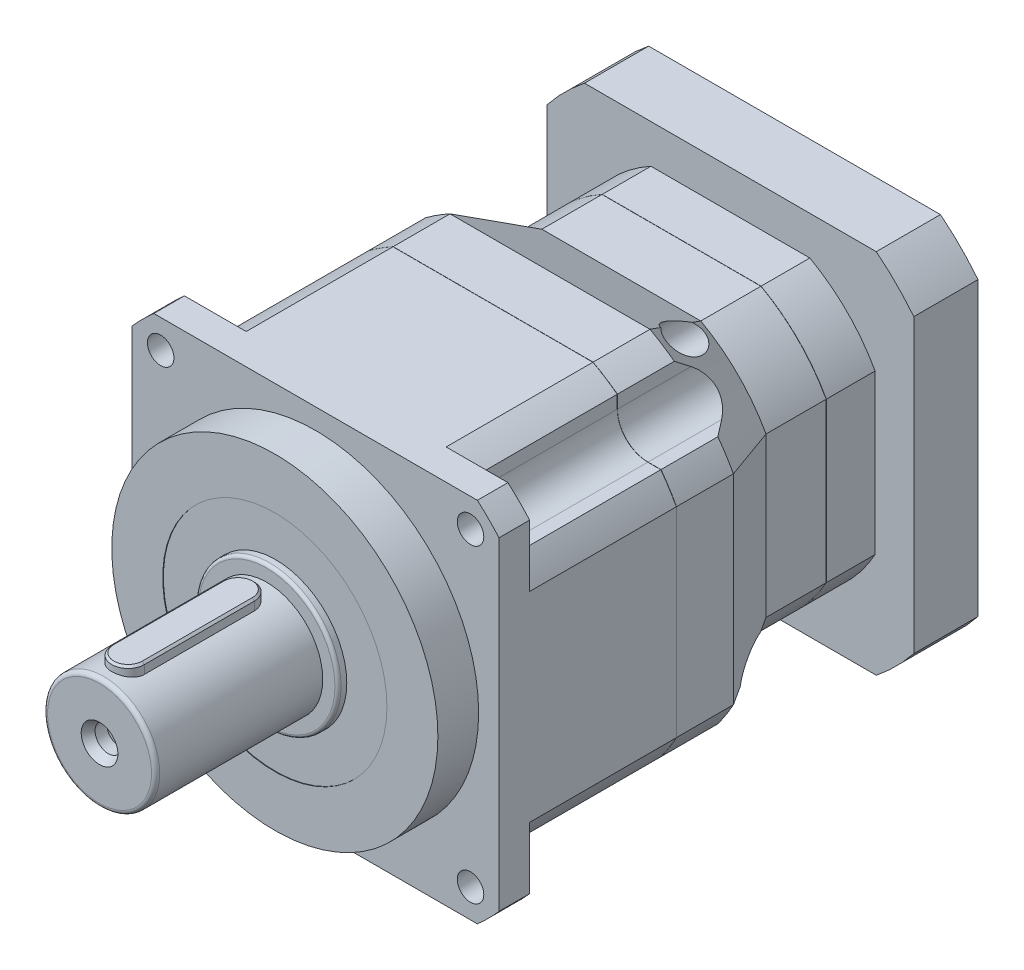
SolidWorks part; units mm, degrees
ref_plane "前视基准面" through (0, 0, 0) normal (0, 0, 1) x (1, 0, 0)
ref_plane "上视基准面" through (0, 0, 0) normal (0, 1, 0) x (1, 0, 0)
ref_plane "右视基准面" through (0, 0, 0) normal (1, 0, 0) x (0, 0, -1)
sketch "草图1" plane through (0, 0, 0) normal (0, 0, 1) x (1, 0, 0)
  line L1 (-79.3725, 90) -> (79.3725, 90)
  line L2 (-90, 79.3725) -> (-90, -79.3725)
  line L3 (-79.3725, -90) -> (79.3725, -90)
  line L4 (90, 79.3725) -> (90, -79.3725)
  arc A0 (-79.3725, 90) -> (-90, 79.3725) centre (0, 0) ccw
  arc A1 (90, 79.3725) -> (79.3725, 90) centre (0, 0) ccw
  arc A2 (79.3725, -90) -> (90, -79.3725) centre (0, 0) ccw
  arc A3 (-90, -79.3725) -> (-79.3725, -90) centre (0, 0) ccw
  dimension "D1" = 90
  dimension "D3" = 90
extrude "凸台-拉伸1" add sketch "草图1" along normal blind 15
sketch "草图2" plane through (0, 0, 15) normal (0, 0, 1) x (1, 0, 0)
  circle A0 centre (0, 0) radius 80
extrude "凸台-拉伸2" add sketch "草图2" along normal blind 20
sketch "草图3" plane through (0, 0, 0) normal (0, 0, -1) x (-1, 0, 0)
  line L0 (-79.3725, 90) -> (79.3725, 90) construction
  line L1 (90, 79.3725) -> (90, -79.3725) construction
  line L2 (79.3725, -90) -> (-79.3725, -90) construction
  line L3 (-90, -79.3725) -> (-90, 79.3725) construction
  line L4 (-49.0535, 90) -> (49.0535, 90)
  line L5 (90, 49.0535) -> (90, -49.0535)
  line L6 (49.0535, -90) -> (-49.0535, -90)
  line L7 (-90, -49.0535) -> (-90, 49.0535)
  arc A0 (-49.0535, 90) -> (-90, 49.0535) centre (0, 0) ccw
  arc A1 (-90, -49.0535) -> (-49.0535, -90) centre (0, 0) ccw
  arc A2 (49.0535, -90) -> (90, -49.0535) centre (0, 0) ccw
  arc A3 (90, 49.0535) -> (49.0535, 90) centre (0, 0) ccw
extrude "凸台-拉伸3" add sketch "草图3" along normal blind 72
sketch "草图4" plane through (0, 0, -72) normal (0, 0, -1) x (-1, 0, 0)
  line L1 (-104.8113, 97.2781) -> (-61, 97.2781)
  line L2 (-104.8113, 97.2781) -> (-104.8113, 61)
  line L3 (-104.8113, 61) -> (-61, 61)
  line L4 (-61, 97.2781) -> (-61, 61)
  dimension "D1" = 61
  dimension "D2" = 61
extrude "切除-拉伸1" cut sketch "草图4" against normal up to surface (72 mm away)
pattern_circular "阵列(圆周)1" count 4 over 360 about axis through (0, 0, 0) along (0, 0, 1) of "切除-拉伸1"
fillet "圆角1" radius 15 4 edges at (61, -61, -36) (-61, -61, -36) (-61, 61, -36) (61, 61, -36)
ref_plane "基准面1" through (0, 0, -72.1) normal (0, 0, -1) x (-1, 0, 0)
sketch "草图5" plane through (0, 0, -72.1) normal (0, 0, -1) x (-1, 0, 0)
  line L1 (-49.0535, 90) -> (49.0535, 90)
  line L2 (-90, 49.0535) -> (-90, -49.0535)
  line L3 (-49.0535, -90) -> (49.0535, -90)
  line L4 (90, 49.0535) -> (90, -49.0535)
  arc A0 (-49.0535, 90) -> (-90, 49.0535) centre (0, 0) ccw
  arc A1 (-90, -49.0535) -> (-49.0535, -90) centre (0, 0) ccw
  arc A2 (49.0535, -90) -> (90, -49.0535) centre (0, 0) ccw
  arc A3 (90, 49.0535) -> (49.0535, 90) centre (0, 0) ccw
  dimension "D1" = 90
  dimension "D3" = 90
extrude "凸台-拉伸4" add sketch "草图5" along normal blind 27.9 separate body
ref_plane "基准面5" through (0, 0, -135) normal (0, 0, -1) x (-1, 0, 0)
sketch "草图25" plane through (0, 0, -135) normal (0, 0, -1) x (-1, 0, 0)
  line L1 (-38.9872, 71) -> (38.9872, 71)
  line L2 (-71, 38.9872) -> (-71, -38.9872)
  line L3 (-38.9872, -71) -> (38.9872, -71)
  line L4 (71, 38.9872) -> (71, -38.9872)
  arc A0 (-38.9872, 71) -> (-71, 38.9872) centre (0, 0) ccw
  arc A1 (-71, -38.9872) -> (-38.9872, -71) centre (0, 0) ccw
  arc A2 (38.9872, -71) -> (71, -38.9872) centre (0, 0) ccw
  arc A3 (71, 38.9872) -> (38.9872, 71) centre (0, 0) ccw
  dimension "D1" = 71
  dimension "D3" = 71
extrude "凸台-拉伸12" add sketch "草图25" along normal blind 29.5 separate body
loft "放样1" add
sketch "草图7" plane through (0, 0, -72.1) normal (0, 0, 1) x (1, 0, 0)
  line L0 (61, 76) -> (61, 82.3726) construction
  line L1 (82.3726, 61) -> (76, 61) construction
  line L2 (61, 76) -> (61, 82.3726)
  line L3 (82.3726, 61) -> (76, 61)
  arc A0 (61, 76) -> (76, 61) centre (76, 76) ccw construction
  arc A1 (61, 76) -> (76, 61) centre (76, 76) ccw
  arc A2 (82.3726, 61) -> (61, 82.3726) centre (0, 0) ccw
extrude "切除-拉伸2" cut sketch "草图7" against normal blind 60
pattern_circular "阵列(圆周)2" count 4 over 360 about axis through (0, 0, 0) along (0, 0, 1) of "切除-拉伸2"
ref_plane "基准面2" through (0, 0, -164.6) normal (0, 0, -1) x (-1, 0, 0)
sketch "草图8" plane through (0, 0, -164.6) normal (0, 0, -1) x (-1, 0, 0)
  line L4 (38.9872, 71) -> (-38.9872, 71) construction
  line L5 (-71, 38.9872) -> (-71, -38.9872) construction
  line L6 (-38.9872, -71) -> (38.9872, -71) construction
  line L7 (71, -38.9872) -> (71, 38.9872) construction
  line L8 (38.9872, 71) -> (-38.9872, 71)
  line L9 (-71, 38.9872) -> (-71, -38.9872)
  line L10 (-38.9872, -71) -> (38.9872, -71)
  line L11 (71, -38.9872) -> (71, 38.9872)
  arc A4 (71, 38.9872) -> (38.9872, 71) centre (0, 0) ccw construction
  arc A5 (-38.9872, 71) -> (-71, 38.9872) centre (0, 0) ccw construction
  arc A6 (-71, -38.9872) -> (-38.9872, -71) centre (0, 0) ccw construction
  arc A7 (38.9872, -71) -> (71, -38.9872) centre (0, 0) ccw construction
  arc A8 (71, 38.9872) -> (38.9872, 71) centre (0, 0) ccw
  arc A9 (-38.9872, 71) -> (-71, 38.9872) centre (0, 0) ccw
  arc A10 (-71, -38.9872) -> (-38.9872, -71) centre (0, 0) ccw
  arc A11 (38.9872, -71) -> (71, -38.9872) centre (0, 0) ccw
extrude "凸台-拉伸5" add sketch "草图8" along normal blind 23.9 separate body
sketch "草图9" plane through (0, 0, -188.5) normal (0, 0, -1) x (-1, 0, 0)
  line L1 (-71.5891, 90) -> (71.5891, 90)
  line L2 (-90, 71.5891) -> (-90, -71.5891)
  line L3 (-71.5891, -90) -> (71.5891, -90)
  line L4 (90, 71.5891) -> (90, -71.5891)
  arc A0 (-71.5891, 90) -> (-90, 71.5891) centre (0, 0) ccw
  arc A1 (-90, -71.5891) -> (-71.5891, -90) centre (0, 0) ccw
  arc A2 (71.5891, -90) -> (90, -71.5891) centre (0, 0) ccw
  arc A3 (90, 71.5891) -> (71.5891, 90) centre (0, 0) ccw
  dimension "D5" = 180
  dimension "D2" = 115
  dimension "D1" = 90
  dimension "D3" = 90
  dimension "D4" = 180
extrude "凸台-拉伸6" add sketch "草图9" along normal blind 31.5
sketch "草图11" plane through (0, 0, -220) normal (0, 0, -1) x (-1, 0, 0)
  circle A0 centre (0, 0) radius 57.15
  dimension "D1" = 114.3
extrude "切除-拉伸3" cut sketch "草图11" against normal blind 8
sketch "草图12" plane through (0, 0, -212) normal (0, 0, -1) x (-1, 0, 0)
  circle A0 centre (0, 0) radius 56.5
extrude "切除-拉伸4" cut sketch "草图12" against normal blind 10.5
sketch "草图26" plane through (0, 0, -201.5) normal (0, 0, -1) x (-1, 0, 0)
  circle A0 centre (0, 0) radius 41.5
extrude "切除-拉伸10" cut sketch "草图26" against normal blind 33
ref_plane "基准面6" through (0, 0, -189) normal (0, 0, -1) x (-1, 0, 0)
sketch "草图27" plane through (0, 0, -189) normal (0, 0, -1) x (-1, 0, 0)
  circle A0 centre (0, 0) radius 37.5
extrude "凸台-拉伸13" add sketch "草图27" against normal up to surface (20.5 mm away)
sketch "草图28" plane through (0, 0, -220) normal (0, 0, -1) x (-1, 0, 0)
  line L0 (0, 0) -> (0, -55) construction
  line L1 (0, 0) -> (-27.5, -47.6314) construction
  circle A0 centre (0, 0) radius 55 construction
  circle A1 centre (-27.5, -47.6314) radius 9
  dimension "D1" = 30
extrude "切除-拉伸11" cut sketch "草图28" against normal blind 39.5
pattern_circular "阵列(圆周)7" count 6 over 360 about axis through (0, 0, 0) along (0, 0, 1) of "切除-拉伸11"
chamfer "倒角4" distance 1 angle 45 1 edges at (-37.5, 0, -189)
sketch "草图29" plane through (0, 0, -220) normal (0, 0, -1) x (-1, 0, 0)
  circle A0 centre (0, 0) radius 17.5
extrude "切除-拉伸12" cut sketch "草图29" against normal blind 85
sketch "草图30" plane through (0, 0, -189) normal (0, 0, -1) x (-1, 0, 0)
  line L1 (-39.1268, 0.5) -> (39.3984, 0.5)
  line L2 (-39.1268, 0.5) -> (-39.1268, -0.5)
  line L3 (-39.1268, -0.5) -> (39.3984, -0.5)
  line L4 (39.3984, 0.5) -> (39.3984, -0.5)
  dimension "D1" = 0.5
  dimension "D2" = 1
extrude "切除-拉伸13" cut sketch "草图30" against normal up to surface (20.5 mm away)
sketch "草图31" plane through (0, 0, -220) normal (0, 0, -1) x (-1, 0, 0)
  line L0 (0, 0) -> (-70.7107, -70.7107)
  circle A0 centre (0, 0) radius 100
hole_wizard "M12 螺纹孔2" positions "3D草图2" profile "草图32" tap size "M12" standard "GB"
sketch3d "3D草图2"
  point P0 (70.7107, -70.7107, -220)
sketch "草图32" plane through (70.7107, -70.7107, -220) normal (1, 0, 0) x (0, 1, 0)
  line L0 (0, 0) -> (0, 30.0644)
  line L1 (0, 30.0644) -> (5.1, 27)
  line L2 (5.1, 27) -> (5.1, 0)
  line L5 (5.1, 0) -> (0, 0)
  line L10 (0, 30.0644) -> (-5.1, 27) construction
  line L11 (0, -6.35) -> (0, 107.95) construction
  dimension "螺纹孔钻头直径" = 10.2
  dimension "螺纹孔钻头深度" = 27
  dimension "导头角度" = 118
pattern_circular "阵列(圆周)8" count 4 over 360 about axis through (0, 0, 0) along (0, 0, 1) of "M12 螺纹孔2"
sketch "草图20" plane through (0, 0, 15) normal (0, 0, 1) x (1, 0, 0)
  line L0 (0, 0) -> (-84.8528, 84.8528) construction
  circle A0 centre (0, 0) radius 107.5 construction
  arc A1 (-79.3725, 90) -> (-90, 79.3725) centre (0, 0) ccw construction
  circle A2 centre (-76.014, 76.014) radius 6.5
extrude "切除-拉伸8" cut sketch "草图20" against normal up to surface (15 mm away)
pattern_circular "阵列(圆周)6" count 4 over 360 about axis through (0, 0, 0) along (0, 0, 1) of "切除-拉伸8"
sketch "草图21" plane through (0, 0, 35) normal (0, 0, 1) x (1, 0, 0)
  circle A0 centre (0, 0) radius 35
extrude "凸台-拉伸9" add sketch "草图21" along normal blind 4
fillet "圆角3" radius 1.5 1 edges at (35, 0, 39)
sketch "草图22" plane through (0, 0, 39) normal (0, 0, 1) x (1, 0, 0)
  circle A0 centre (0, 0) radius 27.5
extrude "凸台-拉伸10" add sketch "草图22" along normal blind 82
fillet "圆角4" radius 2 1 edges at (27.5, 0, 121)
sketch "草图23" plane through (0, 0, 0) normal (0, 1, 0) x (1, 0, 0)
  line L0 (-25.5, -121) -> (25.5, -121) construction
  line L1 (-8, -53) -> (-8, -107)
  line L2 (8, -53) -> (8, -107)
  arc A0 (-8, -107) -> (8, -107) centre (0, -107) ccw
  arc A1 (8, -53) -> (-8, -53) centre (0, -53) ccw
  dimension "D1" = 14
  dimension "D2" = 54
extrude "凸台-拉伸11" add sketch "草图23" along normal blind 31.5
chamfer "倒角3" distance 1 angle 45 4 edges at (-8, 31.5, 80) (0, 31.5, 115) (0, 31.5, 45) (8, 31.5, 80)
sketch "草图24" plane through (0, 0, 35) normal (0, 0, 1) x (1, 0, 0)
  circle A0 centre (0, 0) radius 55
  circle A1 centre (0, 0) radius 35
extrude "切除-拉伸9" cut sketch "草图24" against normal blind 0.3
sketch "草图33" plane through (0, 0, -180.5) normal (0, 0, -1) x (-1, 0, 0)
  line L1 (-53.3617, 3.1137) -> (-56.8775, 2.9756)
  line L2 (-56.8775, 2.9756) -> (-58.5157, -0.1381)
  line L3 (-58.5157, -0.1381) -> (-56.6383, -3.1137)
  line L4 (-56.6383, -3.1137) -> (-53.1225, -2.9756)
  line L5 (-53.1225, -2.9756) -> (-51.4843, 0.1381)
  line L6 (-51.4843, 0.1381) -> (-53.3617, 3.1137)
  circle A0 centre (-55, 0) radius 7
  circle A1 centre (-55, 0) radius 3.047 construction
extrude "凸台-拉伸14" add sketch "草图33" along normal blind 9
pattern_circular "阵列(圆周)9" count 6 over 360 about axis through (0, 0, 0) along (0, 0, 1) of "凸台-拉伸14"
ref_plane "基准面7" through (0, 0, -89) normal (0, 0, -1) x (-1, 0, 0)
sketch "草图34" plane through (0, 0, -89) normal (0, 0, -1) x (-1, 0, 0)
  line L0 (0, 0) -> (0, 91.5) construction
  line L1 (0, 0) -> (-48.4876, 77.5964) construction
  circle A0 centre (0, 0) radius 91.5 construction
  circle A1 centre (-48.4876, 77.5964) radius 8.5
  dimension "D1" = 32
extrude "切除-拉伸14" cut sketch "草图34" along normal blind 90
pattern_circular "阵列(圆周)10" count 4 over 360 about axis through (0, 0, 0) along (0, 0, 1) of "切除-拉伸14"
sketch "草图35" plane through (0, 0, -89) normal (0, 0, -1) x (-1, 0, 0)
  line L1 (-46.7015, 80.5645) -> (-50.165, 80.6273)
  line L2 (-50.165, 80.6273) -> (-51.9511, 77.6591)
  line L3 (-51.9511, 77.6591) -> (-50.2737, 74.6283)
  line L4 (-50.2737, 74.6283) -> (-46.8102, 74.5655)
  line L5 (-46.8102, 74.5655) -> (-45.0241, 77.5337)
  line L6 (-45.0241, 77.5337) -> (-46.7015, 80.5645)
  circle A0 centre (-48.4876, 77.5964) radius 7
  circle A1 centre (-48.4876, 77.5964) radius 3 construction
  dimension "D1" = 6
extrude "凸台-拉伸15" add sketch "草图35" along normal blind 9
pattern_circular "阵列(圆周)11" count 4 over 360 about axis through (0, 0, 0) along (0, 0, 1) of "凸台-拉伸15"
sketch "草图36" plane through (0, 0, 121) normal (0, 0, 1) x (1, 0, 0)
  circle A0 centre (0, 0) radius 6.5
extrude "切除-拉伸15" cut sketch "草图36" against normal blind 10
sketch "草图37" plane through (0, 0, 121) normal (0, 0, 1) x (1, 0, 0)
  circle A0 centre (0, 0) radius 9
ref_plane "基准面8" through (0, 0, 116.7) normal (0, 0, 1) x (1, 0, 0)
sketch "草图38" plane through (0, 0, 116.7) normal (0, 0, 1) x (1, 0, 0)
  circle A0 centre (0, 0) radius 6.5 construction
  circle A1 centre (0, 0) radius 6.5
loft "切除-放样1" cut profiles "草图37", "草图38"
hole_wizard "M12 螺纹孔3" positions "3D草图3" profile "草图39" tap size "M12" standard "GB"
sketch3d "3D草图3"
  line L0 (0, 0, 111) -> (0, 0, 116.7) construction
  point P0 (0, 0, 111)
sketch "草图39" plane through (0, 0, 111) normal (1, 0, 0) x (0, -1, 0)
  line L0 (0, 0) -> (0, 41.8144)
  line L1 (0, 41.8144) -> (5.1, 38.75)
  line L2 (5.1, 38.75) -> (5.1, 0)
  line L5 (5.1, 0) -> (0, 0)
  line L10 (0, 41.8144) -> (-5.1, 38.75) construction
  line L11 (0, -6.35) -> (0, 107.95) construction
  dimension "螺纹孔钻头直径" = 10.2
  dimension "螺纹孔钻头深度" = 38.75
  dimension "导头角度" = 118
